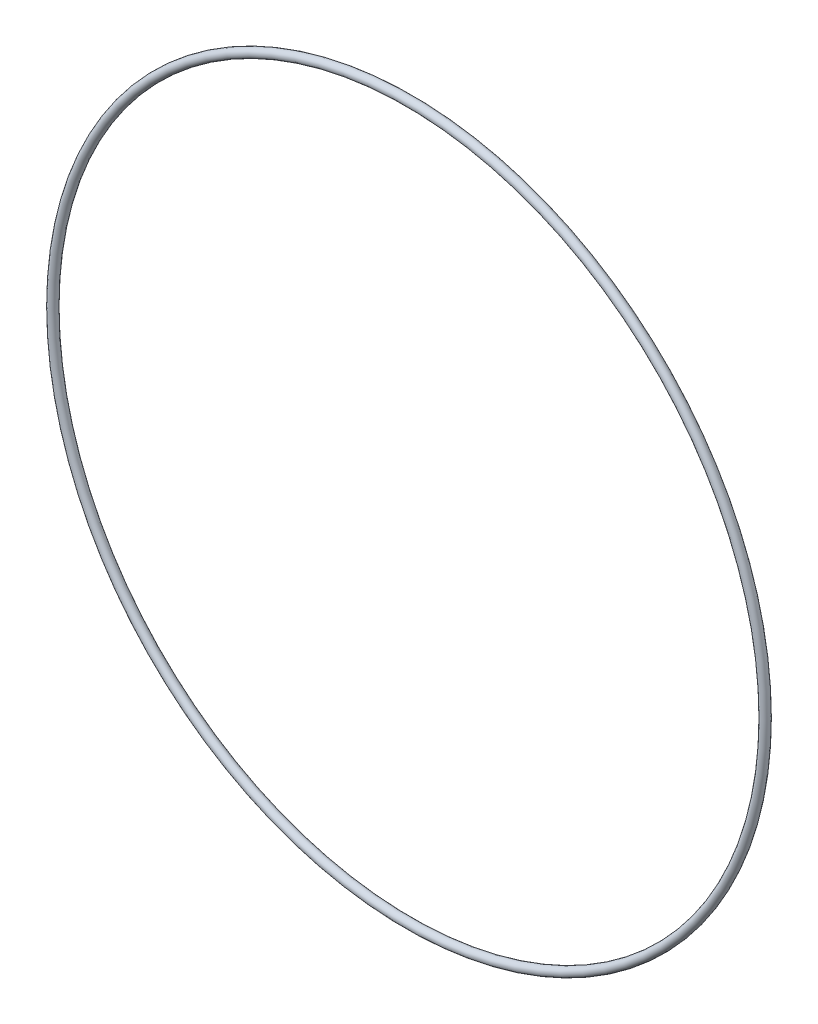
SolidWorks part; units mm, degrees
ref_plane "Front" through (0, 0, 0) normal (0, 0, 1) x (1, 0, 0)
ref_plane "Top" through (0, 0, 0) normal (0, 1, 0) x (1, 0, 0)
ref_plane "Right" through (0, 0, 0) normal (1, 0, 0) x (0, 0, -1)
sketch "Sketch1" plane through (0, 0, 0) normal (1, 0, 0) x (0, -1, 0)
  line L0 (0, -1.3081) -> (0, 1.3081) construction
  line L2 (-117.9487, 0) -> (117.9487, 0) construction
  line L3 (-104.6099, 0) -> (104.6099, 0) construction
  circle A0 centre (105.918, 0) radius 1.3081
  point P9 (104.6099, 0)
  point P10 (107.2261, 0)
  point P13 (105.918, 1.3081)
  point P14 (105.918, -1.3081)
  dimension "Width" = 2.6162
  dimension "ID" = 209.2198
revolve "Revolve1" add sketch "Sketch1" angle 360 about L0
